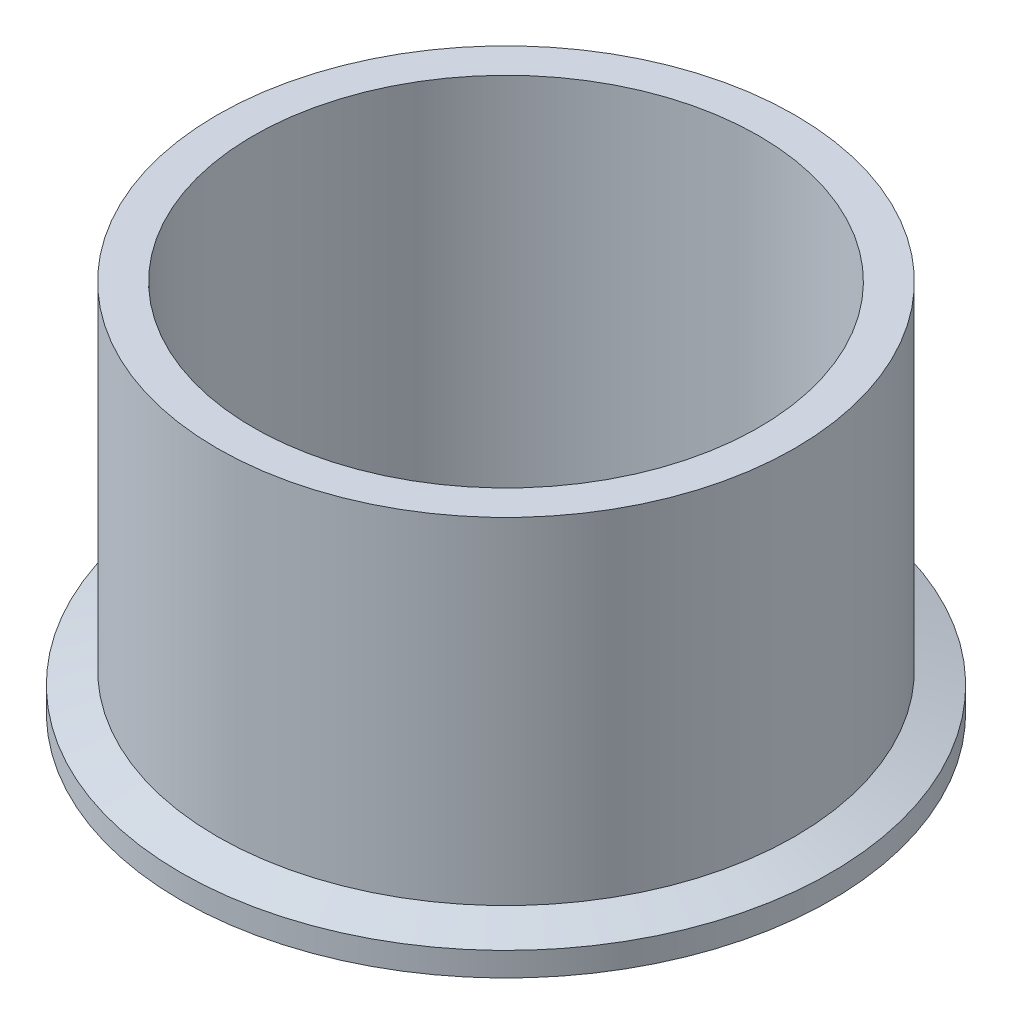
SolidWorks part; units mm, degrees
ref_plane "Front Plane" through (0, 0, 0) normal (0, 0, 1) x (1, 0, 0)
ref_plane "Top Plane" through (0, 0, 0) normal (0, 1, 0) x (1, 0, 0)
ref_plane "Right Plane" through (0, 0, 0) normal (1, 0, 0) x (0, 0, -1)
sketch "Sketch1" plane through (0, 0, 0) normal (0, 0, 1) x (1, 0, 0)
  line L0 (0, 0) -> (0, 44.45) construction
  line L1 (0, 44.45) -> (-34.3916, 44.45)
  line L2 (-34.3916, 44.45) -> (-34.3916, 4.4164)
  line L3 (-34.3916, 4.4164) -> (-38.7096, 2.8448)
  line L4 (-38.7096, 2.8448) -> (-38.7096, 0)
  line L5 (-38.7096, 0) -> (-36.7881, 0)
  line L6 (-33.8556, 0) -> (0, 0)
  line L7 (0, 0) -> (0, 44.45)
  line L8 (0, 44.45) -> (-30.099, 44.45)
  line L9 (-30.099, 44.45) -> (-30.099, 0)
  line L10 (-30.099, 0) -> (0, 0)
  line L11 (0, 0) -> (-0.1846, 0.0129)
  line L12 (-36.7881, 0) -> (-36.4176, 0.8729)
  line L13 (-34.1792, 0.7622) -> (-33.8556, 0)
  line L14 (-35.3187, 0.4064) -> (-35.3187, 2.5172) construction
  arc A0 (-36.4176, 0.8729) -> (-34.1792, 0.7622) centre (-35.3187, 0.4064) cw
  dimension "D6" = 46
  dimension "D7" = 1.1938
  dimension "D5" = 23
  dimension "D1" = 34.3916
  dimension "D2" = 2.8448
  dimension "D3" = 38.7096
  dimension "D4" = 70
  dimension "D8" = 4.2926
  dimension "D9" = 44.45
  dimension "D10" = 0.4064
  dimension "D11" = 35.3187
revolve "Revolve2" add sketch "Sketch1" angle 360 about L0
